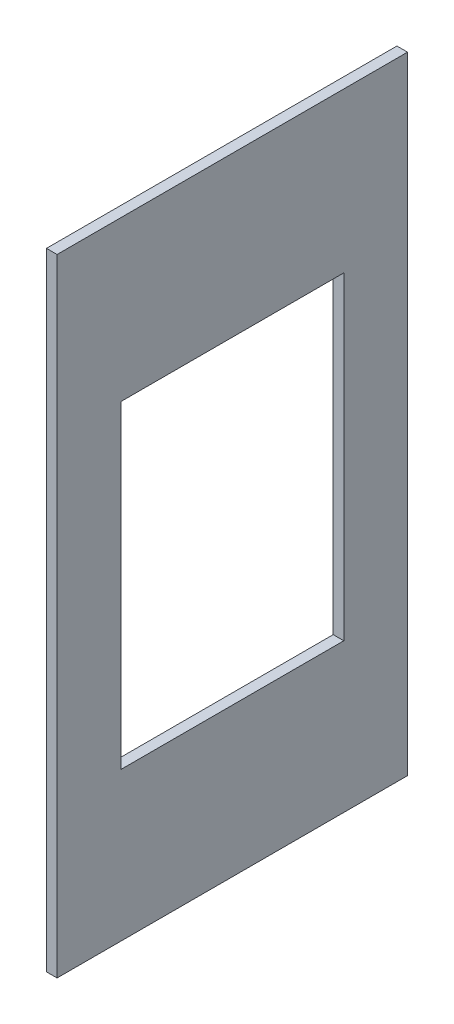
SolidWorks part; units mm, degrees
ref_plane "Front" through (0, 0, 0) normal (0, 0, 1) x (1, 0, 0)
ref_plane "Top" through (0, 0, 0) normal (0, 1, 0) x (1, 0, 0)
ref_plane "Right" through (0, 0, 0) normal (1, 0, 0) x (0, 0, -1)
sketch "Sketch1" plane through (0, 0, 0) normal (1, 0, 0) x (0, 0, -1)
  line L0 (-209.55, 374.65) -> (209.55, -374.65) construction
  line L1 (-209.55, 374.65) -> (209.55, 374.65)
  line L2 (-209.55, 374.65) -> (-209.55, -374.65)
  line L3 (-209.55, -374.65) -> (209.55, -374.65)
  line L4 (209.55, 374.65) -> (209.55, -374.65)
  point P4 (0, 0)
  dimension "D1" = 419.1
  dimension "D3" = 749.3
extrude "Extrude1" add sketch "Sketch1" along normal blind 12.7
sketch "Sketch2" plane through (0, 0, 0) normal (-1, 0, 0) x (0, 0, 1)
  line L0 (-209.55, -374.65) -> (-209.55, 374.65) construction
  line L4 (-209.55, 374.65) -> (209.55, 374.65) construction
  line L6 (209.55, 374.65) -> (209.55, -374.65) construction
  line L8 (133.35, 184.15) -> (-133.35, 184.15)
  line L9 (133.35, 184.15) -> (133.35, -196.85)
  line L10 (133.35, -196.85) -> (-133.35, -196.85)
  line L11 (-133.35, 184.15) -> (-133.35, -196.85)
  line L12 (209.55, -374.65) -> (-209.55, -374.65) construction
  dimension "D1" = 76.2
  dimension "D2" = 190.5
  dimension "D5" = 76.2
  dimension "D6" = 177.8
extrude "Cut-Extrude1" cut sketch "Sketch2" against normal through all
